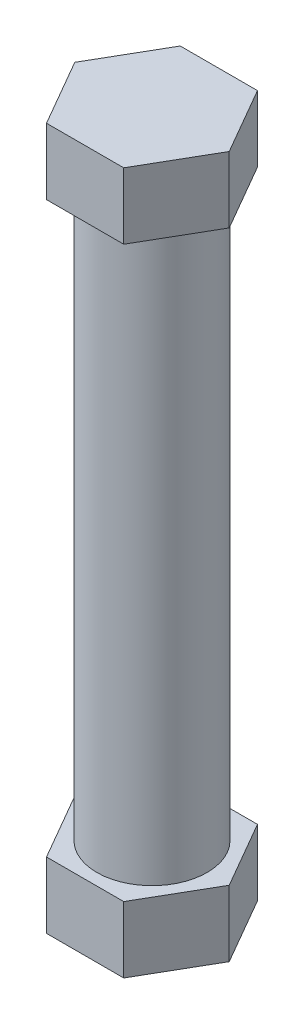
SolidWorks part; units mm, degrees
ref_plane "Front Plane" through (0, 0, 0) normal (0, 0, 1) x (1, 0, 0)
ref_plane "Top Plane" through (0, 0, 0) normal (0, 1, 0) x (1, 0, 0)
ref_plane "Right Plane" through (0, 0, 0) normal (1, 0, 0) x (0, 0, -1)
sketch "Sketch1" plane through (0, 0, 0) normal (0, 1, 0) x (1, 0, 0)
  circle A0 centre (0, 0) radius 3.175
  dimension "D1" = 6.35
extrude "Boss-Extrude1" add sketch "Sketch1" along normal mid plane 32.766 contours A0
sketch "Sketch2" plane through (0, 16.383, 0) normal (0, 1, 0) x (1, 0, 0)
  line L1 (2.2225, 3.8495) -> (-2.2225, 3.8495)
  line L2 (-2.2225, 3.8495) -> (-4.445, 0)
  line L3 (-4.445, 0) -> (-2.2225, -3.8495)
  line L4 (-2.2225, -3.8495) -> (2.2225, -3.8495)
  line L5 (2.2225, -3.8495) -> (4.445, 0)
  line L6 (4.445, 0) -> (2.2225, 3.8495)
  circle A0 centre (0, 0) radius 3.8495 construction
  point P1 (-2.4503, 4.2441)
  dimension "D1" = 8.89
extrude "Boss-Extrude2" add sketch "Sketch2" along normal blind 3.81
mirror "Mirror1" about plane through (0, 0, 0) normal (0, 1, 0) of "Boss-Extrude2"
